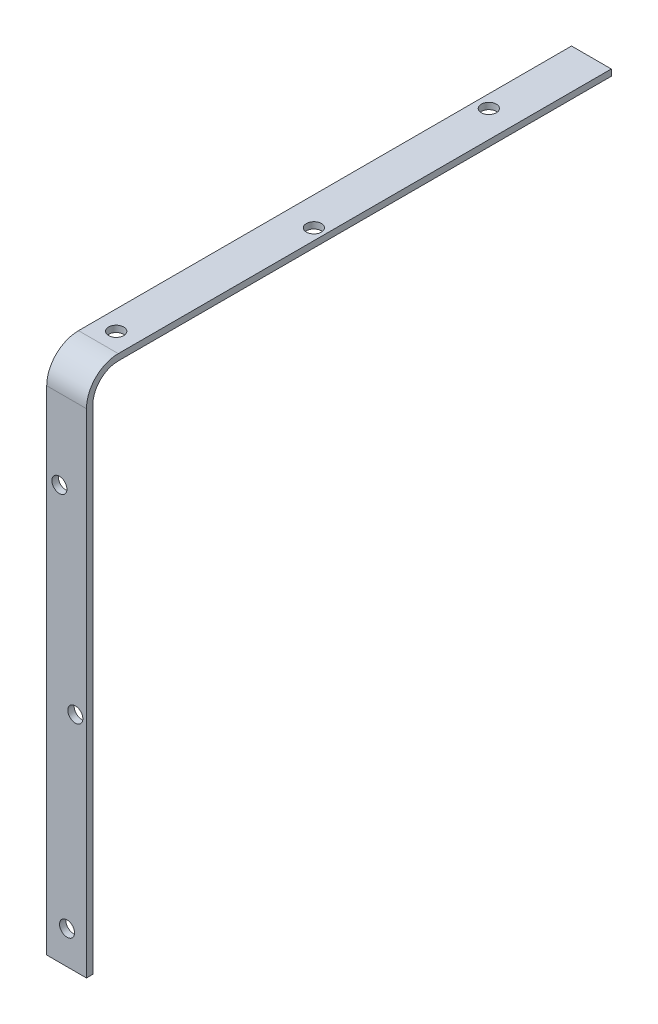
SolidWorks part; units mm, degrees
ref_plane "Front Plane" through (0, 0, 0) normal (0, 0, 1) x (1, 0, 0)
ref_plane "Top Plane" through (0, 0, 0) normal (0, 1, 0) x (1, 0, 0)
ref_plane "Right Plane" through (0, 0, 0) normal (1, 0, 0) x (0, 0, -1)
sketch "Sketch2" plane through (0, 0, 0) normal (1, 0, 0) x (0, 0, -1)
  line L0 (0, 0) -> (0, 196.85)
  line L1 (12.7, 209.55) -> (209.55, 209.55)
  arc A0 (0, 196.85) -> (12.7, 209.55) centre (12.7, 196.85) cw
  point P6 (0, 209.55)
  dimension "D3" = 12.7
  dimension "D1" = 196.85
  dimension "D2" = 196.85
extrude "Extrude-Thin1" add sketch "Sketch2" along normal blind 15.875 thin
hole_wizard "M7x1.0 Tapped Hole1" positions "Sketch3" profile "Sketch4" tap size "M7x1.0" standard "ANSI Metric"
sketch "Sketch3" plane through (0, 209.55, 0) normal (0, 1, 0) x (1, 0, 0)
  line L0 (15.875, 12.7) -> (15.875, 209.55) construction
  line L1 (15.875, 209.55) -> (0, 209.55) construction
  line L2 (0, 12.7) -> (0, 209.55) construction
  point P0 (5.08, 171.45)
  point P2 (11.43, 95.25)
  point P4 (7.747, 20)
  dimension "D1" = 20
  dimension "D2" = 8.128
  dimension "D3" = 38.1
  dimension "D4" = 5.08
  dimension "D5" = 114.3
  dimension "D6" = 11.43
sketch "Sketch4" plane through (5.08, 209.55, -171.45) normal (1, 0, 0) x (0, 0, 1)
  line L0 (0, 0) -> (0, 18.8226)
  line L1 (0, 18.8226) -> (3, 17.02)
  line L2 (3, 17.02) -> (3, 0)
  line L5 (3, 0) -> (0, 0)
  line L10 (0, 18.8226) -> (-3, 17.02) construction
  line L11 (0, -6.35) -> (0, 107.95) construction
  dimension "Tap Drill Dia." = 6
  dimension "Tap Drill Depth" = 17.02
  dimension "Drill Angle" = 118
hole_wizard "M7x1.0 Tapped Hole2" positions "Sketch5" profile "Sketch6" tap size "M7x1.0" standard "ANSI Metric"
sketch "Sketch5" plane through (0, 0, 0) normal (0, 0, 1) x (1, 0, 0)
  point P0 (5.08, 165.1)
  point P2 (11.43, 88.9)
  point P4 (8.128, 13.2127)
  dimension "D1" = 8.128
  dimension "D2" = 13.2127
  dimension "D3" = 88.9
  dimension "D4" = 11.43
  dimension "D5" = 165.1
  dimension "D6" = 5.08
sketch "Sketch6" plane through (5.08, 165.1, 0) normal (1, 0, 0) x (0, -1, 0)
  line L0 (0, 0) -> (0, 18.8226)
  line L1 (0, 18.8226) -> (3, 17.02)
  line L2 (3, 17.02) -> (3, 0)
  line L5 (3, 0) -> (0, 0)
  line L10 (0, 18.8226) -> (-3, 17.02) construction
  line L11 (0, -6.35) -> (0, 107.95) construction
  dimension "Tap Drill Dia." = 6
  dimension "Tap Drill Depth" = 17.02
  dimension "Drill Angle" = 118
